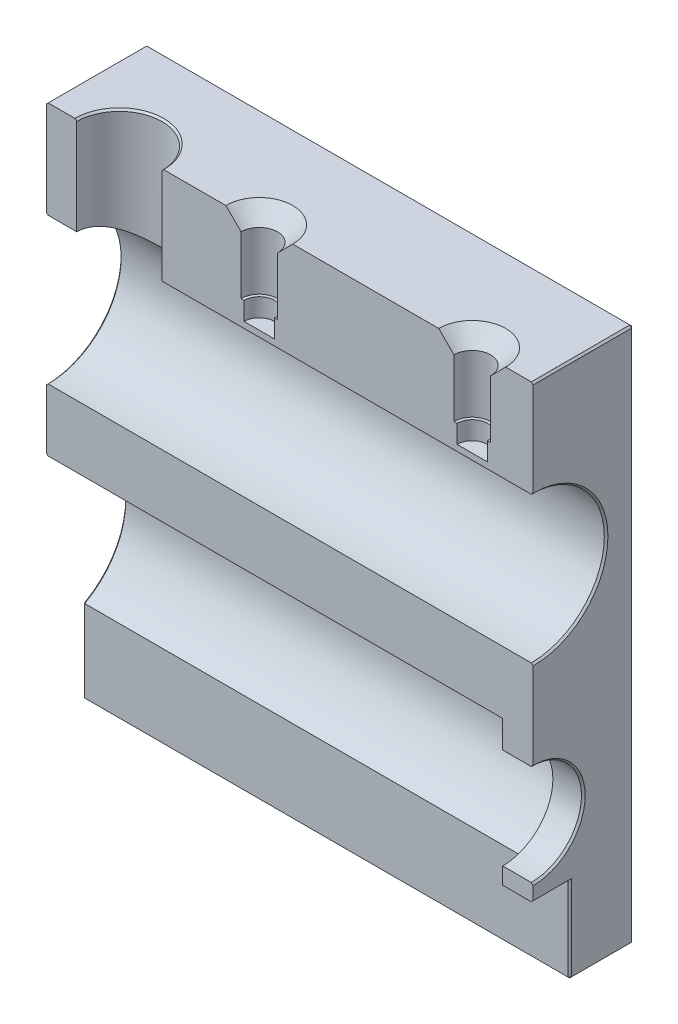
SolidWorks part; units mm, degrees
ref_plane "Plan1" through (0, 0, 0) normal (0, 0, 1) x (1, 0, 0)
ref_plane "Plan2" through (0, 0, 0) normal (0, 1, 0) x (1, 0, 0)
ref_plane "Plan3" through (0, 0, 0) normal (1, 0, 0) x (0, 0, -1)
sketch "Esquisse1" plane through (0, 0, 0) normal (0, 0, 1) x (1, 0, 0)
  line L0 (-40, 44) -> (40, 44)
  line L1 (-40, 44) -> (-40, -44)
  line L2 (40, -44) -> (-40, -44)
  line L3 (40, -44) -> (40, 44)
  point P4 (40, 36)
  dimension "D1" = 88
  dimension "D2" = 44
  dimension "D3" = 80
  dimension "D4" = 40
  dimension "D5" = 8
extrude "Base-Extrusion" add sketch "Esquisse1" along normal blind 35
sketch "Esquisse4" plane through (-40, 0, 0) normal (-1, 0, 0) x (0, 0, 1)
  line L0 (0, 44) -> (0, -44) construction
  line L1 (35, 44) -> (0, 44) construction
  circle A0 centre (16.5, 16) radius 12
  dimension "D2" = 24
  dimension "D1" = 16.5
  dimension "D3" = 28
extrude "Boss.-Extru.2" add sketch "Esquisse4" against normal through all
sketch "Esquisse5" plane through (-40, 0, 0) normal (-1, 0, 0) x (0, 0, 1)
  line L0 (35, 44) -> (35, -44) construction
  circle A0 centre (16.5, 16) radius 12
  dimension "D1" = 18.5
  dimension "D2" = 24
extrude "Enlèv. mat.-Extru.1" cut sketch "Esquisse5" against normal blind 145
sketch "Esquisse6" plane through (40, 0, 0) normal (1, 0, 0) x (0, 0, -1)
  line L1 (-16.5, -48.0139) -> (-16.5, 48.4557) construction
  line L2 (2, 16) -> (-38, 16) construction
  line L3 (-22.5, -44) -> (-22.5, -30)
  line L4 (-35, -44) -> (0, -44) construction
  line L5 (-22.5, -30) -> (-10.5, -30)
  line L6 (-10.5, -30) -> (-10.5, -44)
  line L7 (-10.5, -44) -> (-22.5, -44)
  dimension "D1" = 6
  dimension "D2" = 6
extrude "Enlèv. mat.-Extru.2" cut sketch "Esquisse6" against normal blind 145
sketch "Esquisse12" plane through (-40, 0, 0) normal (-1, 0, 0) x (0, 0, 1)
  line L0 (16.5, 44) -> (16.5, -44) construction
  line L1 (-5, -19) -> (43, -19) construction
  line L2 (10.5, -44) -> (0, -44) construction
  circle A0 centre (16.5, -19) radius 12.75
  dimension "D2" = 25.5
  dimension "D1" = 25
extrude "Enlèv. mat.-Extru.4" cut sketch "Esquisse12" against normal blind 75
sketch "Esquisse13" plane through (35, 0, 0) normal (-1, 0, 0) x (0, 0, 1)
  circle A0 centre (16.5, -19) radius 8.25
  dimension "D1" = 16.5
extrude "Enlèv. mat.-Extru.5" cut sketch "Esquisse13" against normal through all
sketch "Esquisse17" plane through (0, 0, 35) normal (0, 0, 1) x (1, 0, 0)
  line L0 (-44.0286, -19) -> (43.0756, -19) construction
  line L1 (35, -19) -> (-40, -19) construction
  line L2 (-40, -16.4) -> (-20, -16.4)
  line L3 (-40, -16.4) -> (-40, -21.6)
  line L4 (-20, -21.6) -> (-40, -21.6)
  line L5 (-20, -21.6) -> (-20, -16.4)
  line L6 (-40, 44) -> (-40, -44) construction
  dimension "D1" = 5.2
  dimension "D2" = 2.6
extrude "Enlèv. mat.-Extru.9" cut sketch "Esquisse17" against normal blind 10
sketch "Esquisse18" plane through (0, 0, 35) normal (0, 0, 1) x (1, 0, 0)
  line L0 (-43.6474, -19) -> (0, -19) construction
  line L2 (35, -19) -> (-40, -19) construction
  circle A0 centre (-20, -19) radius 2.6
  dimension "D1" = 5.2
extrude "Enlèv. mat.-Extru.10" cut sketch "Esquisse18" against normal blind 10
sketch "Esquisse20" plane through (0, -44, 0) normal (0, -1, 0) x (1, 0, 0)
  line L0 (-10, 43) -> (-10, -7) construction
  line L1 (41.4988, 16.5) -> (-49.1228, 16.5) construction
  line L2 (35, 16.5) -> (-40, 16.5) construction
  line L3 (-4, 3.5) -> (-18, 3.5) construction
  line L4 (-4, 29.5) -> (-18, 29.5) construction
  circle A0 centre (-10, 29.5) radius 2.25
  circle A1 centre (-10, 3.5) radius 2.25
  dimension "D2" = 4.5
  dimension "D1" = 13
extrude "Enlèv. mat.-Extru.12" cut sketch "Esquisse20" against normal blind 14
sketch "Esquisse21" plane through (0, -44, 0) normal (0, -1, 0) x (1, 0, 0)
  line L0 (41.1523, 16.5) -> (-46.1772, 16.5) construction
  line L1 (35, 16.5) -> (-40, 16.5) construction
  circle A0 centre (-10, 3.5) radius 3
  circle A1 centre (-10, 29.5) radius 3
  dimension "D1" = 6
extrude "Enlèv. mat.-Extru.13" cut sketch "Esquisse21" against normal blind 10
chamfer "Chanfrein9" distance 2 angle 30
chamfer "Chanfrein20" distance 2 angle 30
sketch "Esquisse22" plane through (0, 0, 35) normal (0, 0, 1) x (1, 0, 0)
  line L0 (44, -26.25) -> (2, -26.25) construction
  line L2 (31, -18.25) -> (31, -50.25) construction
  line L3 (15, -50.25) -> (15, -19) construction
  line L4 (35, -19) -> (-40, -19) construction
  circle A0 centre (31, -26.25) radius 2
  circle A1 centre (15, -26.25) radius 2
  dimension "D1" = 4
  dimension "D2" = 4
extrude "Enlèv. mat.-Extru.15" cut sketch "Esquisse22" against normal blind 5.5
sketch "Esquisse24" plane through (0, 44, 0) normal (0, 1, 0) x (-1, 0, 0)
  line L0 (28, 37) -> (28, 2) construction
  line L1 (12.5859, 16.5) -> (43.3812, 16.5) construction
  line L2 (-35, 16.5) -> (40, 16.5) construction
  circle A0 centre (28, 16.5) radius 7
  dimension "D1" = 14
extrude "Enlèv. mat.-Extru.23" cut sketch "Esquisse24" against normal blind 25
sketch "Esquisse25" plane through (0, 0, 35) normal (0, 0, 1) x (1, 0, 0)
  line L0 (-28, 44.6957) -> (-28, 13.5487) construction
  line L1 (-28, 13.5487) -> (-28, 29.9025) construction
  line L2 (-38, 38) -> (-17, 38) construction
  circle A0 centre (-28, 38) radius 4
  dimension "D1" = 8
extrude "Enlèv. mat.-Extru.24" cut sketch "Esquisse25" against normal up to next
sketch "Esquisse26" plane through (0, 44, 0) normal (0, 1, 0) x (-1, 0, 0)
  line L0 (-41.9084, 16.5) -> (42.9795, 16.5) construction
  line L2 (-35, 16.5) -> (40, 16.5) construction
  line L3 (5, 25) -> (5, 9) construction
  line L4 (-30, 26) -> (-30, 3.75) construction
  line L5 (-35, 3.75) -> (40, 3.75) construction
  circle A0 centre (-30, 16.5) radius 2.5
  circle A1 centre (5, 16.5) radius 2.5
  dimension "D1" = 5
  dimension "D2" = 5
extrude "Enlèv. mat.-Extru.25" cut sketch "Esquisse26" against normal blind 15
sketch "Esquisse28" plane through (0, 44, 0) normal (0, 1, 0) x (-1, 0, 0)
  circle A0 centre (-30, 16.5) radius 3
  circle A1 centre (5, 16.5) radius 3
  dimension "D1" = 6
  dimension "D2" = 6
extrude "Enlèv. mat.-Extru.26" cut sketch "Esquisse28" against normal blind 12
chamfer "Chanfrein27" distance 2.5 angle 45
chamfer "Chanfrein29" distance 0.3 angle 45
sketch "Esquisse29" plane through (40, 0, 0) normal (1, 0, 0) x (0, 0, -1)
  line L0 (-16.5, 16) -> (-16.5, 86.1619) construction
  line L1 (-16.5, 63.9994) -> (-16.5, -52)
  line L2 (-16.5, -52) -> (-67.7989, -52)
  line L3 (-67.7989, -52) -> (-67.7989, 63.9994)
  line L4 (-67.7989, 63.9994) -> (-16.5, 63.9994)
extrude "Enlèv. mat.-Extru.27" cut sketch "Esquisse29" against normal through all
sketch "Esquisse30" plane through (35, 0, 0) normal (-1, 0, 0) x (0, 0, 1)
  point P0 (16.5, -19)
sketch "Esquisse31" plane through (0, 0, 0) normal (1, 0, 0) x (0, 0, -1)
  arc A0 (-16.5, 4) -> (-16.5, 28) centre (-16.5, 16) ccw construction
  point P0 (-16.5, 16)
